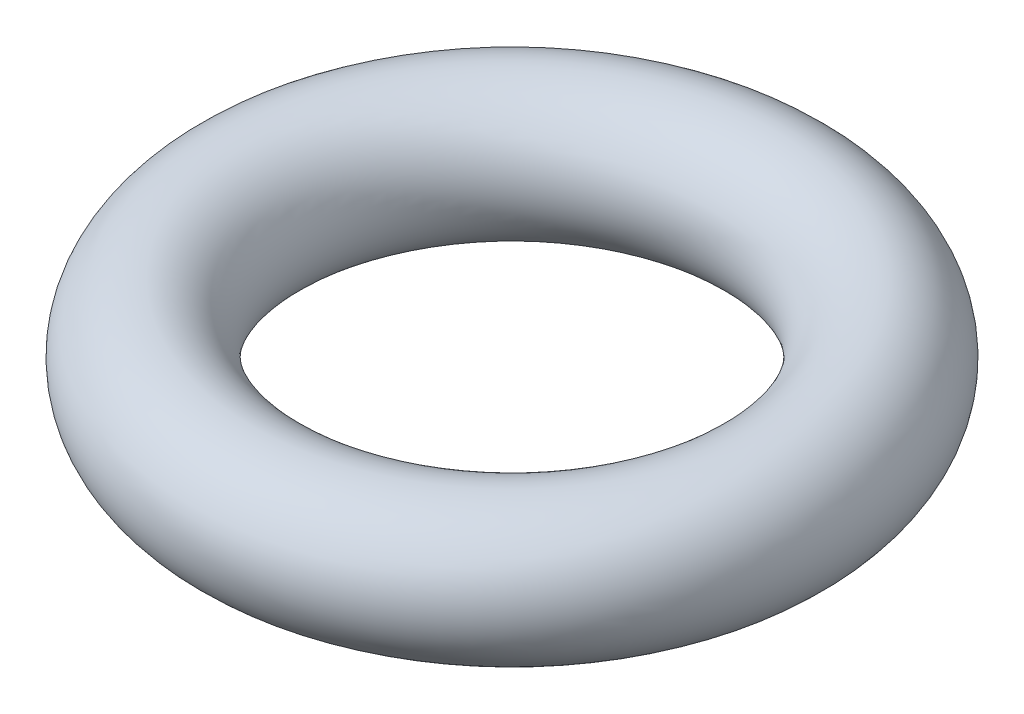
SolidWorks part; units mm, degrees
ref_plane "Anteriore" through (0, 0, 0) normal (0, 0, 1) x (1, 0, 0)
ref_plane "Superiore" through (0, 0, 0) normal (0, 1, 0) x (1, 0, 0)
ref_plane "Destro" through (0, 0, 0) normal (1, 0, 0) x (0, 0, -1)
sketch "Schizzo1" plane through (0, 0, 0) normal (0, 1, 0) x (1, 0, 0)
  line L0 (0, 0) -> (9.5, 0) construction
  circle A0 centre (0, 0) radius 9.5
  circle A1 centre (0, 0) radius 7 construction
  dimension "D1" = 19
  dimension "D2" = 2.5
sketch "Schizzo2" plane through (0, 0, 0) normal (0, 0, 1) x (1, 0, 0)
  circle A0 centre (9.5, 0) radius 2.5
  dimension "D1" = 5
sweep "Sweep1" add profiles "Schizzo2" path "Schizzo1"
